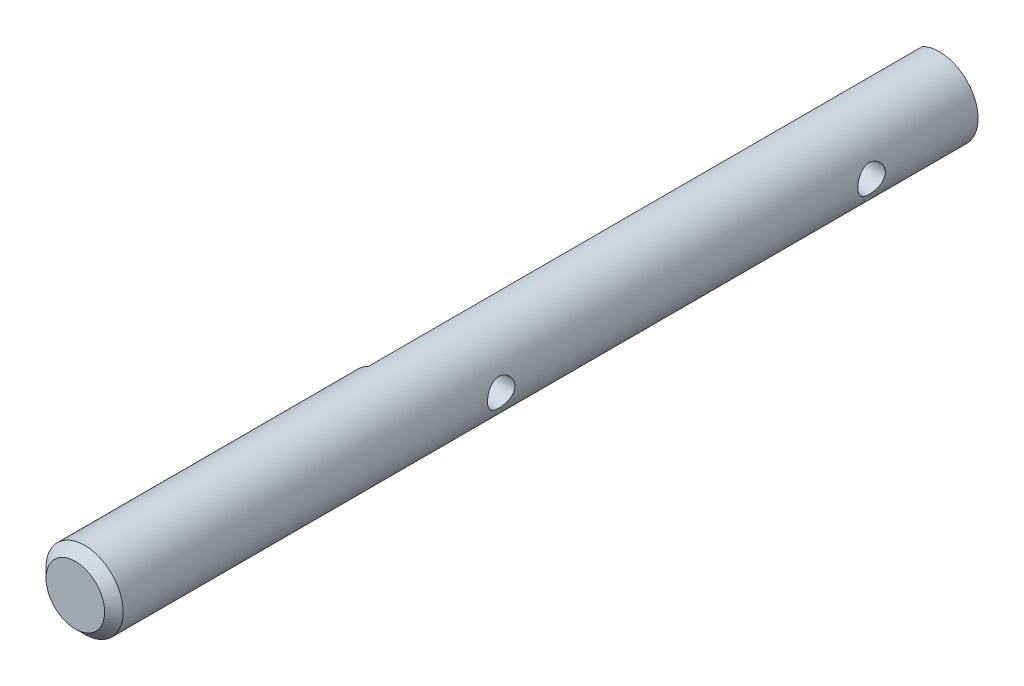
SolidWorks part; units mm, degrees
ref_plane "Front Plane" through (0, 0, 0) normal (0, 0, 1) x (1, 0, 0)
ref_plane "Top Plane" through (0, 0, 0) normal (0, 1, 0) x (1, 0, 0)
ref_plane "Right Plane" through (0, 0, 0) normal (1, 0, 0) x (0, 0, -1)
sketch "Sketch1" plane through (0, 0, 0) normal (0, 0, 1) x (1, 0, 0)
  circle A0 centre (0, 0) radius 3.175
  dimension "D1" = 6.35
extrude "Boss-Extrude1" add sketch "Sketch1" along normal blind 160.02
chamfer "Chamfer1" distance 0.762 angle 45 2 edges at (3.175, 0, 0) (3.175, 0, 160.02)
sketch "Sketch2" plane through (0, 0, 0) normal (1, 0, 0) x (0, 0, -1)
  line L1 (0, -2.413) -> (0, 2.413) construction
  line L2 (0, 0) -> (-160.02, 0) construction
  line L3 (-160.02, 2.413) -> (-160.02, -2.413) construction
  circle A0 centre (-13.843, 0) radius 1.1303
  circle A1 centre (-44.323, 0) radius 1.1303
  circle A2 centre (-97.663, 0) radius 1.1303
  circle A3 centre (-128.143, 0) radius 1.1303
  dimension "D2" = 2.2606
  dimension "D1" = 13.843
  dimension "D3" = 30.48
  dimension "D4" = 53.34
  dimension "D5" = 30.48
extrude "Cut-Extrude1" cut sketch "Sketch2" against normal through all and the other way through all
sketch "Sketch3" plane through (0, 0, 0) normal (1, 0, 0) x (0, 0, -1)
  line L0 (-0.762, 3.175) -> (-159.258, 3.175) construction
  line L1 (-7.493, 3.175) -> (-134.493, 3.175)
  line L2 (-7.493, 3.175) -> (-7.493, -3.175)
  line L3 (-7.493, -3.175) -> (-134.493, -3.175)
  line L4 (-134.493, 3.175) -> (-134.493, -3.175)
  line L5 (-44.323, 0) -> (-97.663, 0) construction
  line L6 (-70.993, 3.175) -> (-70.993, -3.175) construction
  point P13 (-70.993, 0)
  dimension "D1" = 127
extrude "Cut-Extrude2" cut sketch "Sketch3" along normal blind 1.778 from offset 3.175
sketch "Sketch4" plane through (0, 0, 0) normal (0, 0, -1) x (-1, 0, 0)
  circle A0 centre (0, 0) radius 3.175 construction
  circle A1 centre (0, 0) radius 3.175
extrude "Cut-Extrude3" cut sketch "Sketch4" against normal blind 88.9
